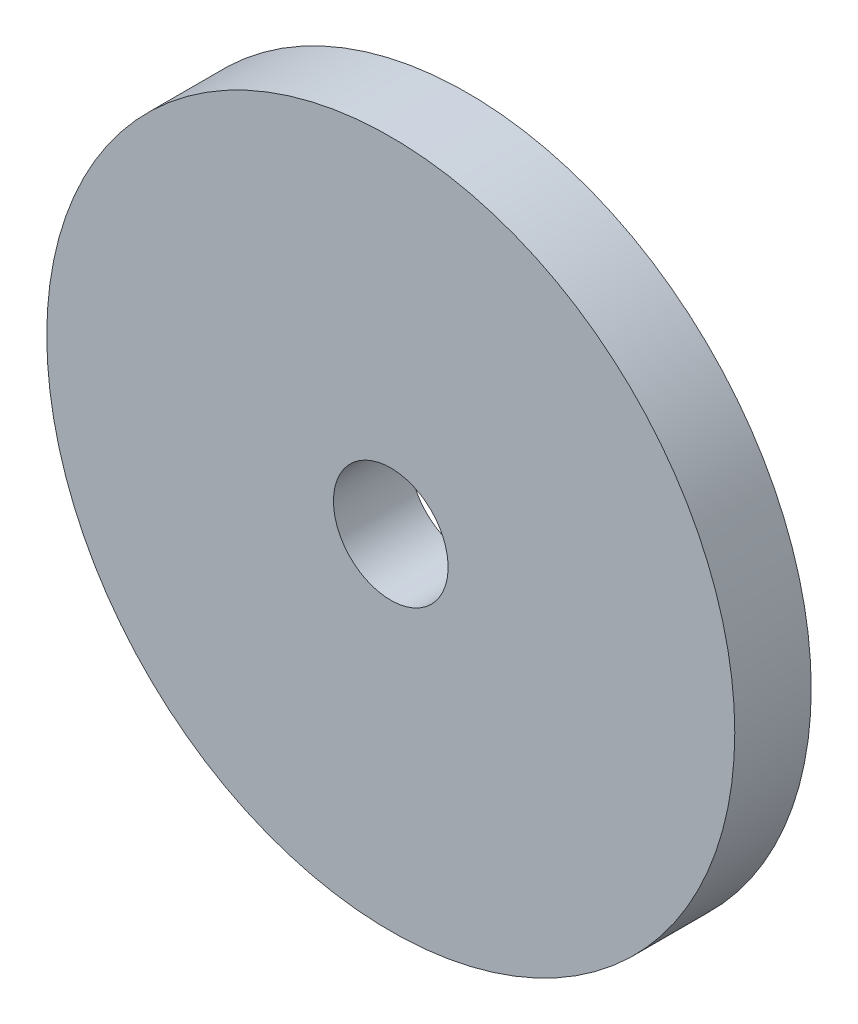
SolidWorks part; units mm, degrees
ref_plane "前视" through (0, 0, 0) normal (0, 0, 1) x (1, 0, 0)
ref_plane "上视" through (0, 0, 0) normal (0, 1, 0) x (1, 0, 0)
ref_plane "右视" through (0, 0, 0) normal (1, 0, 0) x (0, 0, -1)
sketch "草图1" plane through (0, 0, 0) normal (0, 0, 1) x (1, 0, 0)
  circle A0 centre (0, 0) radius 18
extrude "凸台-拉伸1" add sketch "草图1" along normal blind 4
sketch "草图2" plane through (0, 0, 0) normal (0, 0, -1) x (-1, 0, 0)
  circle A0 centre (0, 0) radius 3
  dimension "D1" = 6
extrude "切除-拉伸1" cut sketch "草图2" against normal blind 4
